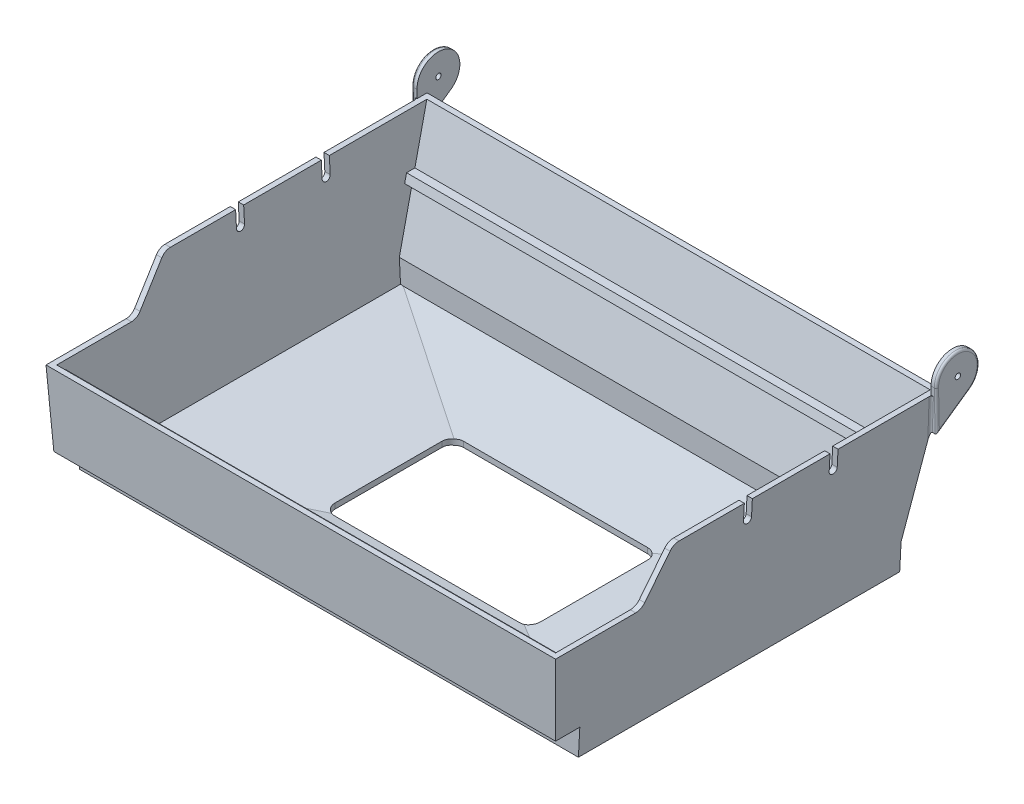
SolidWorks part; units mm, degrees
ref_plane "Front Plane" through (0, 0, 0) normal (0, 0, 1) x (1, 0, 0)
ref_plane "Top Plane" through (0, 0, 0) normal (0, 1, 0) x (1, 0, 0)
ref_plane "Right Plane" through (0, 0, 0) normal (1, 0, 0) x (0, 0, -1)
sketch "Sketch1" plane through (0, 0, 0) normal (0, 1, 0) x (1, 0, 0)
  line L1 (304.8, -228.6) -> (-304.8, -228.6)
  line L2 (304.8, -228.6) -> (304.8, 228.6)
  line L3 (304.8, 228.6) -> (-304.8, 228.6)
  line L4 (-304.8, -228.6) -> (-304.8, 228.6)
  line L5 (304.8, -228.6) -> (-304.8, 228.6) construction
  line L6 (304.8, 228.6) -> (-304.8, -228.6) construction
  point P0 (0, 0)
  dimension "D1" = 609.6
  dimension "D2" = 457.2
extrude "Extrude1" add sketch "Sketch1" against normal blind 203.2 draft 3
sketch "Sketch2" plane through (0, 0, 0) normal (1, 0, 0) x (0, 0, -1)
  line L0 (-88.7671, 0) -> (-124.3377, -50.8)
  line L1 (-228.6, 0) -> (228.6, 0) construction
  line L2 (-124.3377, -50.8) -> (-225.9377, -50.8)
  line L3 (-217.9507, -203.2) -> (-228.6, 0) construction
  line L4 (188.4493, -203.2) -> (188.4493, -139.7)
  line L5 (-217.9507, -203.2) -> (217.9507, -203.2) construction
  line L6 (188.4493, -139.7) -> (228.6, 0)
  line L7 (-192.5507, -203.2) -> (-192.5507, -139.7)
  line L8 (-192.5507, -139.7) -> (-221.2786, -139.7)
  line L9 (-192.5507, -203.2) -> (-217.9507, -203.2)
  line L10 (-217.9507, -203.2) -> (-221.2786, -139.7)
  line L11 (-225.9377, -50.8) -> (-228.6, 0)
  line L12 (-228.6, 0) -> (-88.7671, 0)
  line L13 (188.4493, -203.2) -> (217.9507, -203.2)
  line L14 (217.9507, -203.2) -> (228.6, 0)
  dimension "D1" = 125
  dimension "D2" = 50.8
  dimension "D3" = 101.6
  dimension "D4" = 25.4
  dimension "D5" = 29.5015
  dimension "D6" = 63.5
extrude "Extrude2" cut sketch "Sketch2" against normal through all and the other way through all
fillet "Fillet1" radius 12.7 2 edges at (0, -50.8, 124.3377) (0, 0, 88.7671)
sketch "Sketch8" plane through (0, 0, -188.4493) normal (0, 0, -1) x (-1, 0, 0)
  line L0 (-295.8147, -171.45) -> (0, -203.2)
  line L1 (-297.4786, -139.7) -> (-294.1507, -203.2) construction
  line L2 (294.1507, -203.2) -> (-294.1507, -203.2) construction
  line L3 (295.8147, -171.45) -> (0, -203.2)
  line L4 (294.1507, -203.2) -> (297.4786, -139.7) construction
extrude "Extrude8" cut sketch "Sketch8" against normal through all and the other way through all
sketch "Sketch9" plane through (0, 0, 0) normal (1, 0, 0) x (0, 0, -1)
  line L0 (-192.5507, -171.45) -> (-2.0507, -203.2)
  line L1 (188.4493, -203.2) -> (-192.5507, -203.2) construction
  line L2 (-2.0507, -203.2) -> (188.4493, -171.45)
extrude "Extrude9" cut sketch "Sketch9" against normal through all and the other way through all flip side to cut
shell "Shell2" thickness 6.35
sketch "Sketch4" plane through (0, 0, 0) normal (1, 0, 0) x (0, 0, -1)
  line L0 (96.8375, 0) -> (96.8375, -19.05)
  line L1 (-82.1559, 0) -> (228.6, 0) construction
  line L2 (106.3625, -19.05) -> (106.3625, 0)
  line L3 (106.3625, 0) -> (96.8375, 0)
  line L4 (-4.7625, 0) -> (-4.7625, -19.05)
  line L5 (4.7625, -19.05) -> (4.7625, 0)
  line L6 (4.7625, 0) -> (-4.7625, 0)
  arc A0 (-4.7625, -19.05) -> (4.7625, -19.05) centre (0, -19.05) ccw
  arc A3 (96.8375, -19.05) -> (106.3625, -19.05) centre (101.6, -19.05) ccw
  dimension "D2" = 19.05
  dimension "D4" = 101.6
  dimension "D3" = 9.525
extrude "Extrude4" cut sketch "Sketch4" against normal through all and the other way through all
sketch "Sketch7" plane through (0, 0, 0) normal (1, 0, 0) x (0, 0, -1)
  line L0 (-225.4385, -60.325) -> (211.2622, -60.325) construction
  line L1 (-221.2786, -139.7) -> (-225.9377, -50.8) construction
  line L2 (228.6, 0) -> (188.4493, -139.7) construction
  line L3 (-225.9377, -50.8) -> (-130.9489, -50.8) construction
  line L4 (-219.0798, -60.325) -> (-209.5548, -60.325)
  line L5 (-219.0798, -60.325) -> (-218.5806, -69.85)
  line L6 (-209.5548, -60.325) -> (-209.0556, -69.85)
  line L7 (-218.5806, -69.85) -> (-209.0556, -69.85)
  line L8 (-215.2527, -133.35) -> (-219.579, -50.8) construction
  line L9 (204.6551, -60.325) -> (194.7445, -60.325)
  line L10 (204.6551, -60.325) -> (201.9176, -69.85)
  line L11 (194.7445, -60.325) -> (192.007, -69.85)
  line L12 (201.9176, -69.85) -> (192.007, -69.85)
  line L13 (182.0993, -138.8056) -> (221.9929, 0) construction
  dimension "D1" = 9.525
  dimension "D2" = 9.525
  dimension "D3" = 9.525
  dimension "D4" = 9.525
  dimension "D5" = 9.525
extrude "Extrude6" add sketch "Sketch7" along normal up to body and the other way up to body separate body
sketch "Sketch10" plane through (0, 0, 0) normal (0, 1, 0) x (1, 0, 0)
  line L0 (-0.4763, -2.0507) -> (-286.4305, 182.0993) construction
  line L1 (109.2866, -76.2) -> (-109.2866, -76.2)
  line L2 (121.9866, -63.5) -> (121.9866, 63.5)
  line L3 (109.2866, 76.2) -> (-109.2866, 76.2)
  line L4 (-121.9866, -63.5) -> (-121.9866, 63.5)
  line L5 (121.9866, -76.2) -> (-121.9866, 76.2) construction
  line L6 (121.9866, 76.2) -> (-121.9866, -76.2) construction
  arc A0 (-109.2866, 76.2) -> (-121.9866, 63.5) centre (-109.2866, 63.5) ccw
  arc A1 (121.9866, 63.5) -> (109.2866, 76.2) centre (109.2866, 63.5) ccw
  arc A2 (109.2866, -76.2) -> (121.9866, -63.5) centre (109.2866, -63.5) ccw
  arc A3 (-109.2866, -76.2) -> (-121.9866, -63.5) centre (-109.2866, -63.5) cw
  point P0 (0, 0)
  dimension "D2" = 12.7
  dimension "D1" = 152.4
extrude "Extrude10" cut sketch "Sketch10" against normal through all
ref_plane "Plane1" through (304.8, 0, 0) normal (1, 0, 0) x (0, 0, -1)
sketch "Sketch12" plane through (304.8, 0, 0) normal (1, 0, 0) x (0, 0, -1)
  line L0 (217.6498, -38.1) -> (256.7095, -10.6119)
  line L1 (228.6, 0) -> (188.4493, -139.7) construction
  line L3 (216.6964, 9.653) -> (217.6498, -38.1)
  line L4 (106.3625, 0) -> (228.6, 0) construction
  arc A0 (256.7095, -10.6119) -> (216.6964, 9.653) centre (242.0914, 10.16) ccw
  dimension "D1" = 25.4
  dimension "D2" = 10.16
  dimension "D3" = 10.16
  dimension "D4" = 38.1
extrude "Extrude11" add sketch "Sketch12" along normal blind 6.35 and the other way up to surface separate body
sketch "Sketch21" plane through (304.8, 0, 0) normal (-1, 0, 0) x (0, 0, 1)
  line L0 (-256.7095, -10.6119) -> (-217.6498, -38.1) construction
  line L1 (-256.7095, -10.6119) -> (-217.6498, -38.1)
  line L2 (-216.8891, 0) -> (-265.3708, 0) construction
  line L3 (-265.3708, 0) -> (-228.6, 0)
  line L4 (-228.6, 0) -> (-217.6498, -38.1)
  line L5 (-188.4493, -139.7) -> (-228.6, 0) construction
  arc A0 (-265.3708, 0) -> (-256.7095, -10.6119) centre (-242.0914, 10.16) ccw construction
  arc A1 (-265.3708, 0) -> (-256.7095, -10.6119) centre (-242.0914, 10.16) ccw
extrude "Extrude21" cut sketch "Sketch21" along normal through all
mirror "Mirror2" about plane through (0, 0, 0) normal (1, 0, 0)
combine bodies "Combine1" operation type add bodies to combine 112 115 120
fillet "Fillet2" radius 2.54 8 edges at (311.15, -24.3559, -237.1796) (311.15, -14.2235, -217.1731) (311.15, 32.8196, -253.5675) (-311.15, -14.2235, -217.1731) (-311.15, -24.3559, -237.1796) (-311.15, 32.8196, -253.5675)
sketch "Sketch15" plane through (311.15, 0, 0) normal (1, 0, 0) x (0, 0, -1)
  circle A0 centre (242.0914, 10.16) radius 3.175
  dimension "D1" = 6.35
extrude "Extrude12" cut sketch "Sketch15" against normal through all
